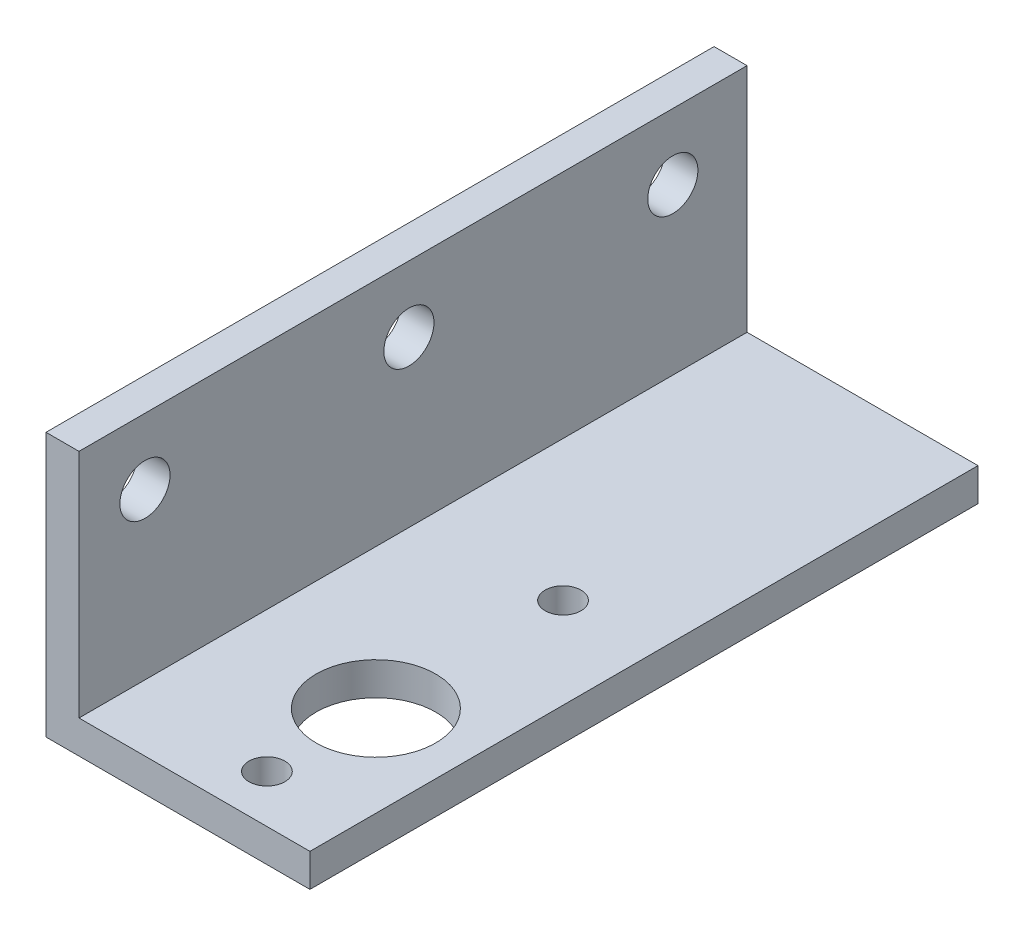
SolidWorks part; units mm, degrees
ref_plane "Front Plane" through (0, 0, 0) normal (0, 0, 1) x (1, 0, 0)
ref_plane "Top Plane" through (0, 0, 0) normal (0, 1, 0) x (1, 0, 0)
ref_plane "Right Plane" through (0, 0, 0) normal (1, 0, 0) x (0, 0, -1)
sketch "Sketch1" plane through (0, 0, 0) normal (0, 0, 1) x (1, 0, 0)
  line L0 (0, 0) -> (0, -25.4)
  line L1 (0, -25.4) -> (25.4, -25.4)
  line L2 (25.4, -25.4) -> (25.4, -22.225)
  line L3 (25.4, -22.225) -> (3.175, -22.225)
  line L4 (3.175, -22.225) -> (3.175, 0)
  line L5 (3.175, 0) -> (0, 0)
  dimension "D1" = 25.4
  dimension "D2" = 25.4
  dimension "D3" = 3.175
  dimension "D4" = 3.175
extrude "Boss-Extrude1" add sketch "Sketch1" along normal blind 64.2938
sketch "Sketch2" plane through (0, -22.225, 0) normal (0, 1, 0) x (1, 0, 0)
  line L2 (25.4, -64.2938) -> (3.175, -64.2938) construction
  line L4 (25.4, -64.2938) -> (25.4, 0) construction
  circle A2 centre (16.6687, -49.2125) radius 5.7531
  dimension "D2" = 8.7312
  dimension "D4" = 11.5062
  dimension "D1" = 15.0813
extrude "Cut-Extrude1" cut sketch "Sketch2" against normal up to next
hole_wizard "#5 Clearance Hole1" positions "Sketch11" profile "Sketch10" hole size "#5" standard "ANSI Inch"
sketch "Sketch11" plane through (0, -22.225, 0) normal (0, 1, 0) x (-1, 0, 0)
  circle A0 centre (-16.6687, 49.2125) radius 5.7531 construction
  point P0 (-16.6687, 31.2039)
  point P2 (-16.6687, 59.7027)
  dimension "D2" = 18.0086
  dimension "D1" = 28.4988
sketch "Sketch10" plane through (16.6688, -22.225, 31.2039) normal (1, 0, 0) x (0, 0, 1)
  line L0 (0, 0) -> (0, 3.175)
  line L1 (0, 3.175) -> (1.7272, 3.175)
  line L2 (1.7272, 3.175) -> (1.7272, 0)
  line L5 (1.7272, 0) -> (0, 0)
  line L11 (0, -6.35) -> (0, 107.95) construction
  dimension "Thru Hole Dia." = 3.4544
  dimension "Thru Hole Depth" = 3.175
sketch "Sketch13" plane through (3.175, 0, 0) normal (1, 0, 0) x (0, 0, -1)
  line L6 (-64.2938, -22.225) -> (-64.2938, 0) construction
  circle A0 centre (-57.9437, -6.35) radius 2.413
  circle A1 centre (-32.5437, -6.35) radius 2.413
  circle A2 centre (-7.1437, -6.35) radius 2.413
  dimension "D1" = 4.826
  dimension "D2" = 50.8
  dimension "D3" = 25.4
  dimension "D5" = 6.35
  dimension "D4" = 6.35
  dimension "D6" = 25.4
extrude "Cut-Extrude2" cut sketch "Sketch13" against normal up to next
